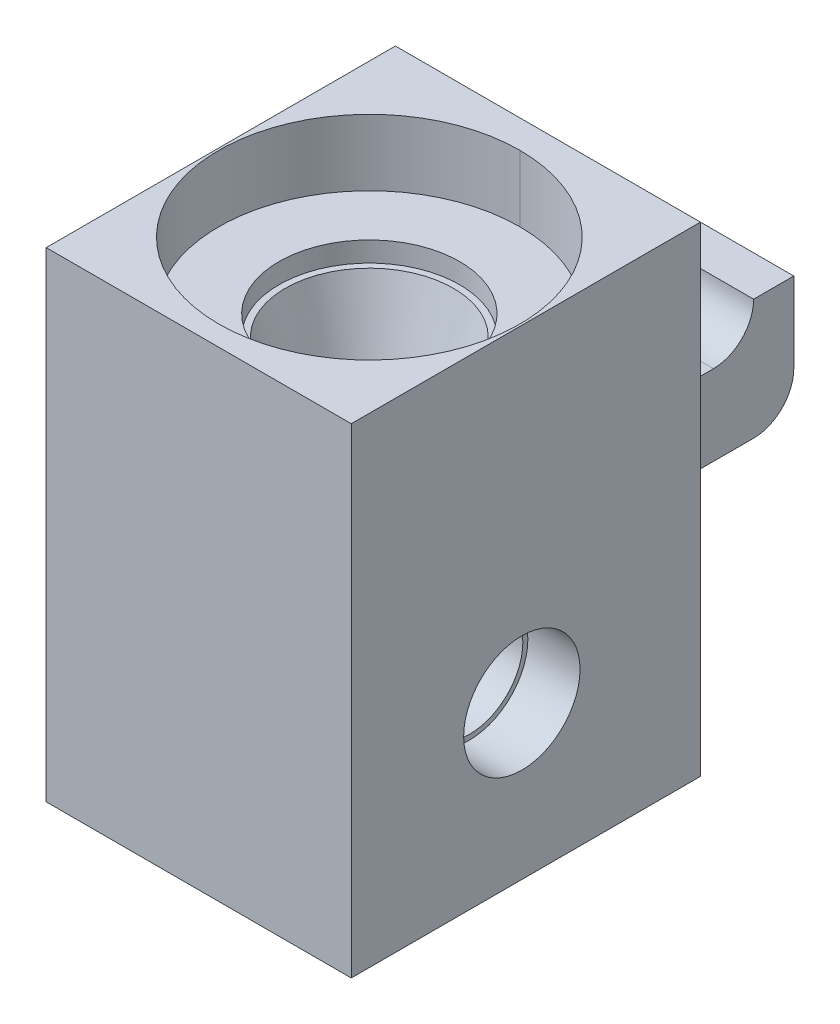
SolidWorks part; units mm, degrees
ref_plane "Front Plane" through (0, 0, 0) normal (0, 0, 1) x (1, 0, 0)
ref_plane "Top Plane" through (0, 0, 0) normal (0, 1, 0) x (1, 0, 0)
ref_plane "Right Plane" through (0, 0, 0) normal (1, 0, 0) x (0, 0, -1)
sketch "Sketch2" plane through (0, 0, 0) normal (0, 1, 0) x (1, 0, 0)
  line L1 (-10, -12.5) -> (10, -12.5)
  line L2 (-10, -12.5) -> (-10, 12.5)
  line L3 (-10, 12.5) -> (10, 12.5)
  line L4 (10, -12.5) -> (10, 12.5)
  line L5 (-10, -12.5) -> (10, 12.5) construction
  line L6 (-10, 12.5) -> (10, -12.5) construction
  point P11 (0, 0)
  dimension "D1" = 25
  dimension "D2" = 20
extrude "Boss-Extrude4" add sketch "Sketch2" along normal blind 20.62 contours L3 L4 L1 L2
sketch "Sketch5" plane through (10, 0, 0) normal (1, 0, 0) x (0, 0, -1)
  line L0 (-12.5, 20.62) -> (12.5, 20.62) construction
  circle A0 centre (0, 5.62) radius 2.9
  dimension "D2" = 5.8
  dimension "D1" = 15
extrude "Cut-Extrude3" cut sketch "Sketch5" against normal blind 5
sketch "Sketch6" plane through (5, 0, 0) normal (1, 0, 0) x (0, 0, -1)
  circle A0 centre (0, 5.62) radius 2.65
  dimension "D1" = 5.3
extrude "Cut-Extrude4" cut sketch "Sketch6" against normal blind 59.5 draft 0.2
sketch "Sketch8" plane through (-10, 0, 0) normal (-1, 0, 0) x (0, 0, 1)
  circle A5 centre (0, 5.62) radius 2.8
  dimension "D1" = 5.6
extrude "Cut-Extrude5" cut sketch "Sketch8" against normal blind 5
ref_plane "Plane1" through (0, 0, 0) normal (-1, 0, 0) x (0, 0, 1)
sketch "Sketch9" plane through (0, 0, 0) normal (-1, 0, 0) x (0, 0, 1)
  line L0 (0, 20.62) -> (0, 3.0049) construction
  line L1 (12.5, 20.62) -> (-12.5, 20.62) construction
  line L2 (0, 3.0049) -> (4.198, 17.6449)
  line L3 (0, 3.0049) -> (0, 17.6449)
  line L4 (0, 17.6449) -> (4.198, 17.6449)
  circle A3 centre (0, 5.62) radius 2.6151 construction
  dimension "D1" = 16
  dimension "D2" = 14.64
revolve "Cut-Revolve1" cut sketch "Sketch9" angle 360 about L0
sketch "Sketch10" plane through (0, 20.62, 0) normal (0, 1, 0) x (1, 0, 0)
  line L0 (0, 3.08) -> (0, -3.08) construction
  circle A0 centre (0, 0) radius 4.5
  dimension "D1" = 9
extrude "Cut-Extrude6" cut sketch "Sketch10" against normal blind 3
sketch "Sketch11" plane through (0, 20.62, 0) normal (0, 1, 0) x (1, 0, 0)
  line L0 (-0.0005, 0) -> (0.0005, 0) construction
  line L1 (-0.0005, 7.5) -> (0.0005, 7.5)
  line L2 (-0.0005, -7.5) -> (0.0005, -7.5)
  line L5 (-10, 12.5) -> (10, 12.5) construction
  line L6 (0, 3.08) -> (0, -3.08) construction
  arc A0 (-0.0005, 7.5) -> (-0.0005, -7.5) centre (-0.0005, 0) ccw
  arc A1 (0.0005, -7.5) -> (0.0005, 7.5) centre (0.0005, 0) ccw
  point P2 (0, 0)
  dimension "D2" = 15
  dimension "D3" = 0.001
  dimension "D1" = 12.5
extrude "Cut-Extrude7" cut sketch "Sketch11" against normal blind 2
sketch "Sketch13" plane through (0, 20.62, 0) normal (0, 1, 0) x (1, 0, 0)
  line L0 (-0.0005, -7.5) -> (0.0005, -7.5) construction
  line L1 (0.0005, 7.5) -> (-0.0005, 7.5) construction
  line L2 (-0.0005, -7.5) -> (0.0005, -7.5)
  line L3 (0.0005, 7.5) -> (-0.0005, 7.5)
  line L4 (-10, 12.5) -> (-10, -12.5)
  line L5 (-10, -12.5) -> (10, -12.5)
  line L6 (10, -12.5) -> (10, 12.5)
  line L7 (10, 12.5) -> (-10, 12.5)
  line L8 (-10, 12.5) -> (-10, -12.5)
  line L9 (-10, -12.5) -> (10, -12.5)
  line L10 (10, -12.5) -> (10, 12.5)
  line L11 (10, 12.5) -> (-10, 12.5)
  arc A0 (-0.0005, 7.5) -> (-0.0005, -7.5) centre (-0.0005, 0) ccw construction
  arc A1 (0.0005, -7.5) -> (0.0005, 7.5) centre (0.0005, 0) ccw construction
  arc A2 (-0.0005, 7.5) -> (-0.0005, -7.5) centre (-0.0005, 0) ccw
  arc A3 (0.0005, -7.5) -> (0.0005, 7.5) centre (0.0005, 0) ccw
  dimension "D1" = 0
extrude "Boss-Extrude6" add sketch "Sketch13" along normal blind 2
sketch "Sketch12" plane through (0, 0, 0) normal (0, -1, 0) x (1, 0, 0)
  line L4 (10, -12.5) -> (10, 12.5)
  line L5 (10, 12.5) -> (-10, 12.5)
  line L6 (-10, 12.5) -> (-10, -12.5)
  line L7 (-10, -12.5) -> (10, -12.5)
  line L8 (10, -12.5) -> (10, 12.5)
  line L9 (10, 12.5) -> (-10, 12.5)
  line L10 (-10, 12.5) -> (-10, -12.5)
  line L11 (-10, -12.5) -> (10, -12.5)
  dimension "D1" = 0
extrude "Boss-Extrude5" add sketch "Sketch12" along normal blind 2
sketch "Sketch14" plane through (0, 18.62, 0) normal (0, 1, 0) x (1, 0, 0)
  circle A0 centre (0, 0) radius 2
extrude "Cut-Extrude8" cut sketch "Sketch14" against normal blind 11
sketch "Sketch15" plane through (10, 0, 0) normal (1, 0, 0) x (0, 0, -1)
  line L0 (12.5, 22.62) -> (12.5, -2) construction
  line L1 (-12.5, 22.62) -> (12.5, 22.62)
  line L2 (-12.5, 22.62) -> (-12.5, 21.92)
  line L3 (-12.5, 21.92) -> (12.5, 21.92)
  line L4 (12.5, 22.62) -> (12.5, 21.92)
  dimension "D1" = 0.7
extrude "Cut-Extrude9" cut sketch "Sketch15" against normal through all
sketch "Sketch16" plane through (10, 0, 0) normal (1, 0, 0) x (0, 0, -1)
  line L0 (12.5, -2) -> (-12.5, -2) construction
  line L1 (12.5, 21.92) -> (8.9, 21.92)
  line L2 (12.5, 21.92) -> (12.5, -2)
  line L3 (12.5, -2) -> (8.9, -2)
  line L4 (8.9, 21.92) -> (8.9, -2)
  dimension "D1" = 3.6
extrude "Cut-Extrude10" cut sketch "Sketch16" against normal through all and the other way through all
sketch "Sketch17" plane through (10, 0, 0) normal (1, 0, 0) x (0, 0, -1)
  line L0 (8.9, -2) -> (-12.5, -2) construction
  line L1 (-12.5, 21.92) -> (-8.5, 21.92)
  line L2 (-12.5, 21.92) -> (-12.5, -2)
  line L3 (-12.5, -2) -> (-8.5, -2)
  line L4 (-8.5, 21.92) -> (-8.5, -2)
  dimension "D1" = 4
extrude "Cut-Extrude11" cut sketch "Sketch17" against normal through all
sketch "Sketch18" plane through (0, 21.92, 0) normal (0, 1, 0) x (1, 0, 0)
  line L0 (-10, -8.5) -> (10, -8.5) construction
  line L1 (-10, 8.9) -> (-7.6, 8.9)
  line L2 (-10, 8.9) -> (-10, -8.5)
  line L3 (-10, -8.5) -> (-7.6, -8.5)
  line L4 (-7.6, 8.9) -> (-7.6, -8.5)
  line L6 (10, 8.9) -> (7.6, 8.9)
  line L7 (10, 8.9) -> (10, -8.5)
  line L8 (10, -8.5) -> (7.6, -8.5)
  line L9 (7.6, 8.9) -> (7.6, -8.5)
  point P12 (-10, 0.2)
  dimension "D1" = 2.4
  dimension "D2" = 2.4
extrude "Cut-Extrude14" cut sketch "Sketch18" against normal through all
sketch "Sketch19" plane through (0, 0, -8.9) normal (0, 0, -1) x (-1, 0, 0)
  line L0 (7.6, 21.92) -> (-7.6, 21.92) construction
  line L1 (-4.25, 11.92) -> (4.25, 11.92)
  line L2 (-4.25, 11.92) -> (-4.25, 7.92)
  line L3 (-4.25, 7.92) -> (4.25, 7.92)
  line L4 (4.25, 11.92) -> (4.25, 7.92)
  line L5 (-7.6, -2) -> (-7.6, 21.92) construction
  dimension "D1" = 10
  dimension "D2" = 4
  dimension "D3" = 8.5
  dimension "D4" = 3.35
extrude "Boss-Extrude7" add sketch "Sketch19" along normal blind 8
sketch "Sketch20" plane through (0, 11.92, 0) normal (0, 1, 0) x (1, 0, 0)
  line L0 (-4.25, 16.9) -> (-4.25, 8.9) construction
  line L1 (4.25, 16.9) -> (-4.25, 16.9)
  line L2 (4.25, 16.9) -> (4.25, 14.9)
  line L3 (4.25, 14.9) -> (-4.25, 14.9)
  line L4 (-4.25, 16.9) -> (-4.25, 14.9)
  dimension "D1" = 2
extrude "Boss-Extrude8" add sketch "Sketch20" along normal blind 2
fillet "Fillet1" radius 2 1 edges at (0, 11.92, -14.9)
fillet "Fillet2" radius 2 1 edges at (0, 7.92, -16.9)
